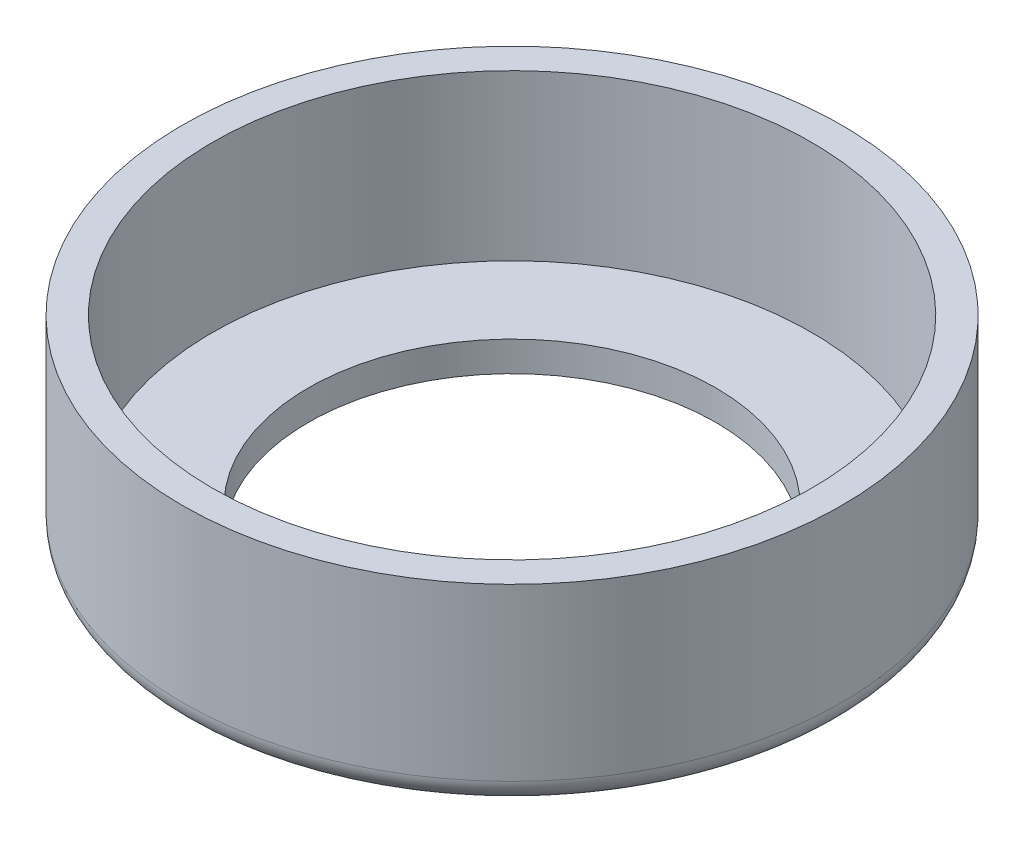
SolidWorks part; units mm, degrees
ref_plane "Front Plane" through (0, 0, 0) normal (0, 0, 1) x (1, 0, 0)
ref_plane "Top Plane" through (0, 0, 0) normal (0, 1, 0) x (1, 0, 0)
ref_plane "Right Plane" through (0, 0, 0) normal (1, 0, 0) x (0, 0, -1)
sketch "Sketch1" plane through (0, 0, 0) normal (0, 1, 0) x (1, 0, 0)
  circle A0 centre (0, 0) radius 17.4625
  dimension "D1" = 34.925
extrude "Extrude1" add sketch "Sketch1" along normal blind 10.3124
fillet "Fillet1" radius 1.27 1 edges at (0, 0, 17.4625)
shell "Shell1" thickness 1.5875
sketch "Sketch2" plane through (0, 0, 0) normal (0, -1, 0) x (1, 0, 0)
  circle A0 centre (0, 0) radius 10.795
  dimension "D1" = 21.59
extrude "Cut-Extrude1" cut sketch "Sketch2" against normal through all
